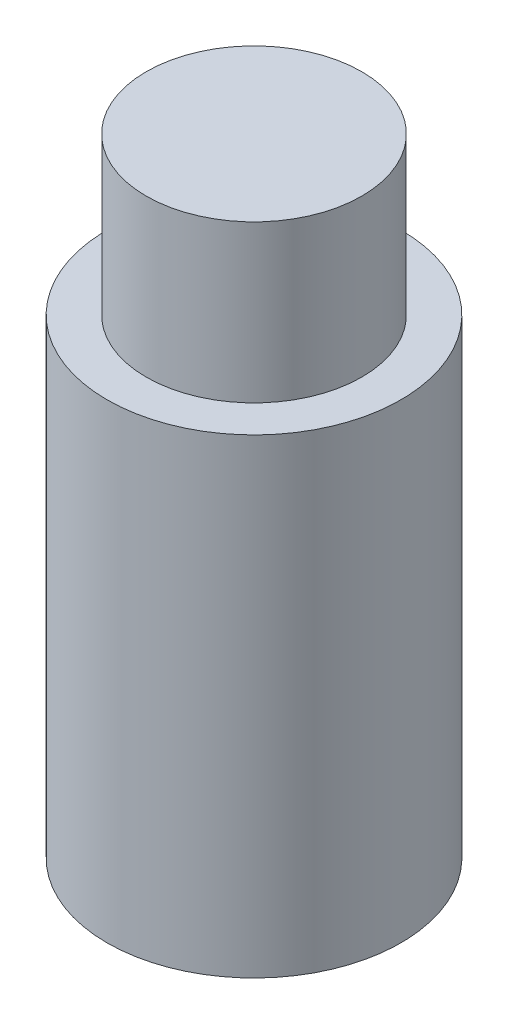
SolidWorks part; units mm, degrees
ref_plane "Спереди" through (0, 0, 0) normal (0, 0, 1) x (1, 0, 0)
ref_plane "Сверху" through (0, 0, 0) normal (0, 1, 0) x (1, 0, 0)
ref_plane "Справа" through (0, 0, 0) normal (1, 0, 0) x (0, 0, -1)
sketch "Эскиз1" plane through (0, 0, 0) normal (1, 0, 0) x (0, 0, -1)
  line L0 (0, 0) -> (0, 16) construction
  line L1 (0, 16) -> (-2.75, 16)
  line L2 (-2.75, 16) -> (-2.75, 12)
  line L3 (-2.75, 12) -> (-3.75, 12)
  line L4 (-3.75, 12) -> (-3.75, 0)
  line L5 (-3.75, 0) -> (-1.75, 0)
  line L6 (-1.75, 0) -> (-1.75, 3)
  line L7 (-1.75, 3) -> (0, 3)
  line L8 (0, 0) -> (-1.75, 0) construction
  line L9 (0, 16) -> (0, 3)
  dimension "D1" = 5.5
  dimension "D2" = 9
  dimension "D3" = 4
  dimension "D4" = 3
  dimension "D5" = 3.5
  dimension "D6" = 2
revolve "Повернуть1" add sketch "Эскиз1" angle 360 about L9
